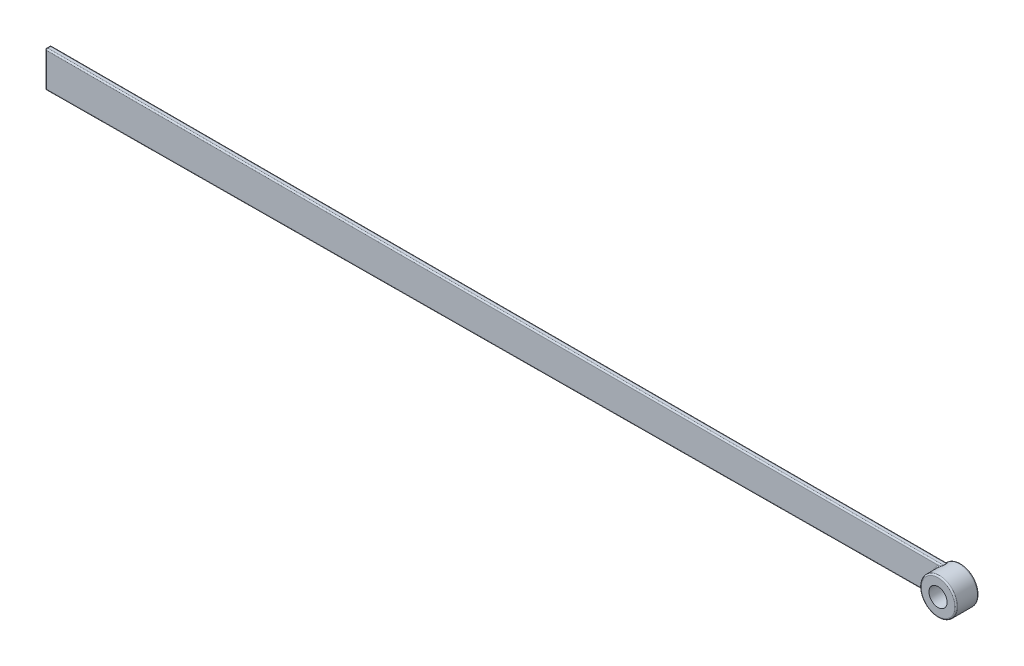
SolidWorks part; units mm, degrees
ref_plane "Plane1" through (0, 0, 0) normal (0, 0, 1) x (1, 0, 0)
ref_plane "Plane2" through (0, 0, 0) normal (0, 1, 0) x (1, 0, 0)
ref_plane "Plane3" through (0, 0, 0) normal (1, 0, 0) x (0, 0, -1)
sketch "Esquisse1" plane through (0, 0, 0) normal (0, 0, 1) x (1, 0, 0)
  circle A0 centre (0, 0) radius 40
  dimension "D1" = 80
extrude "Base-Extrusion" add sketch "Esquisse1" along normal mid plane 50
ref_plane "Plan4" through (0, 0, -10) normal (0, 0, -1) x (-1, 0, 0)
sketch "Esquisse2" plane through (0, 0, -10) normal (0, 0, -1) x (-1, 0, 0)
  line L1 (19.374, 34.995) -> (2000, 34.995)
  line L2 (23.5259, -32.3501) -> (2000, -45.005)
  line L3 (2000, 34.995) -> (2000, -45.005)
  circle A0 centre (0, 0) radius 40 construction
  arc A1 (23.5259, -32.3501) -> (19.374, 34.995) centre (0, 0) ccw
  circle A2 centre (0, 0) radius 40 construction
  dimension "D1" = 80
  dimension "D2" = 2000
extrude "Boss.-Extru.1" add sketch "Esquisse2" along normal mid plane 12
sketch "Esquisse3" plane through (0, 0, 25) normal (0, 0, 1) x (1, 0, 0)
  circle A0 centre (0, 0) radius 20
  dimension "D1" = 40
extrude "Enlèv. mat.-Extru.1" cut sketch "Esquisse3" against normal through all
fillet "Congé1" radius 3
